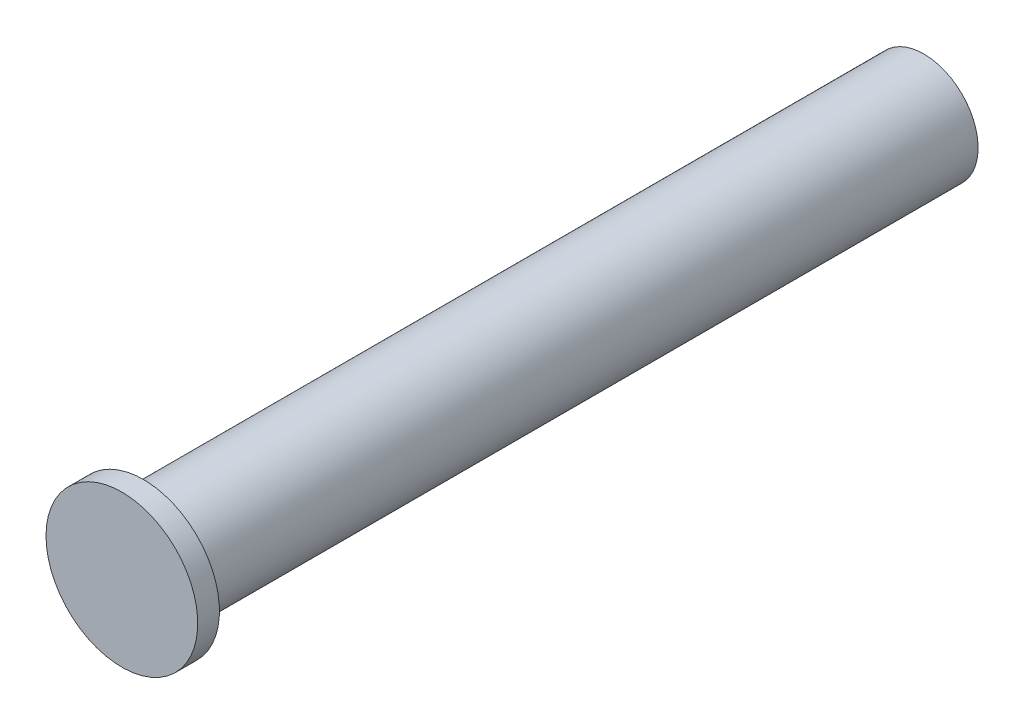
SolidWorks part; units mm, degrees
ref_plane "Plano frontal" through (0, 0, 0) normal (0, 0, 1) x (1, 0, 0)
ref_plane "Plano superior" through (0, 0, 0) normal (0, 1, 0) x (1, 0, 0)
ref_plane "Plano direito" through (0, 0, 0) normal (1, 0, 0) x (0, 0, -1)
sketch "Esboço1" plane through (0, 0, 0) normal (0, 1, 0) x (1, 0, 0)
  line L0 (0, 0) -> (7, 0)
  line L1 (7, 0) -> (7, 2)
  line L2 (7, 2) -> (5, 2)
  line L3 (5, 2) -> (5, 74)
  line L4 (5, 74) -> (0, 74)
  line L5 (0, 74) -> (0, 0)
  dimension "D1" = 5
  dimension "D2" = 7
  dimension "D3" = 74
  dimension "D4" = 2
revolve "Revolução1" add sketch "Esboço1" angle 360 about L5
